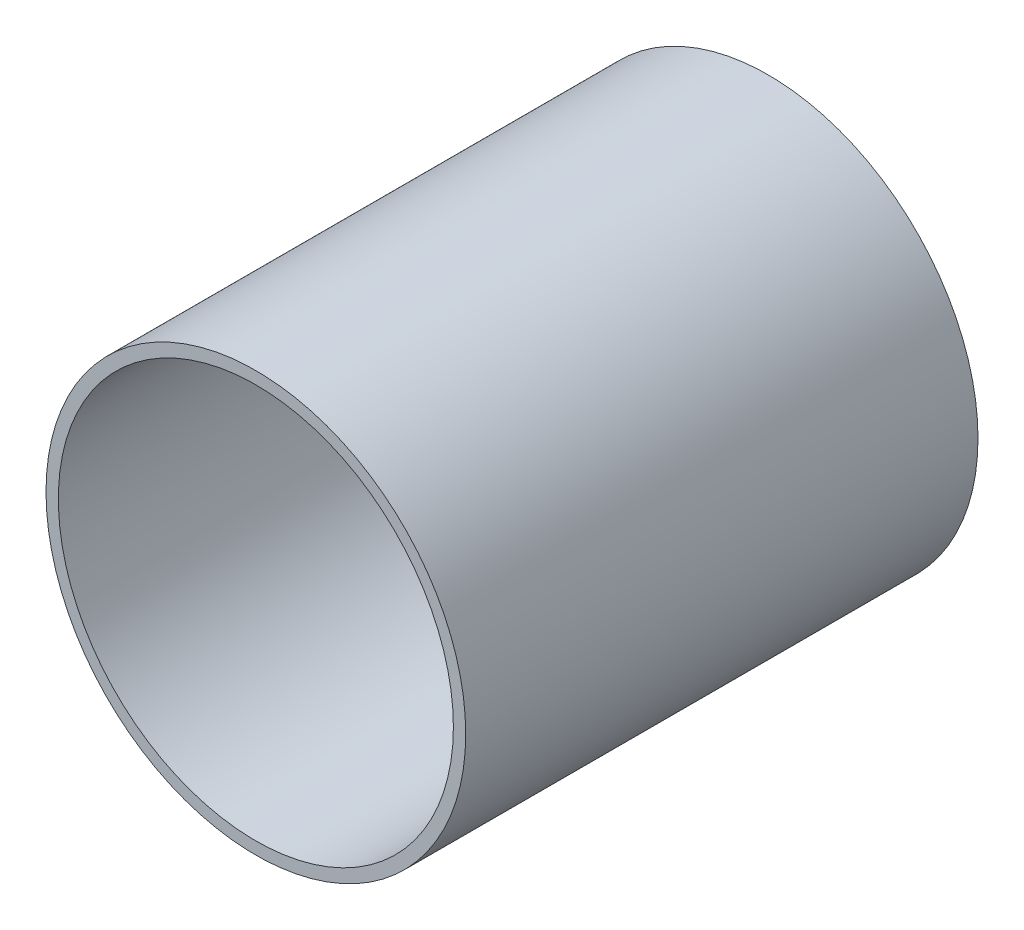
SolidWorks part; units mm, degrees
ref_plane "Front Plane" through (0, 0, 0) normal (0, 0, 1) x (1, 0, 0)
ref_plane "Top Plane" through (0, 0, 0) normal (0, 1, 0) x (1, 0, 0)
ref_plane "Right Plane" through (0, 0, 0) normal (1, 0, 0) x (0, 0, -1)
sketch "Sketch1" plane through (0, 0, 0) normal (0, 0, 1) x (1, 0, 0)
  circle A0 centre (0, 0) radius 50.8
  circle A1 centre (0, 0) radius 53.975
  dimension "D1" = 101.6
  dimension "D2" = 3.175
extrude "Boss-Extrude1" add sketch "Sketch1" along normal blind 127
sketch "Sketch2" plane through (0, 0, 0) normal (0, 0, -1) x (-1, 0, 0)
  circle A0 centre (0, 0) radius 53.975
  dimension "D1" = 107.95
extrude "Boss-Extrude2" add sketch "Sketch2" along normal blind 4.7498
